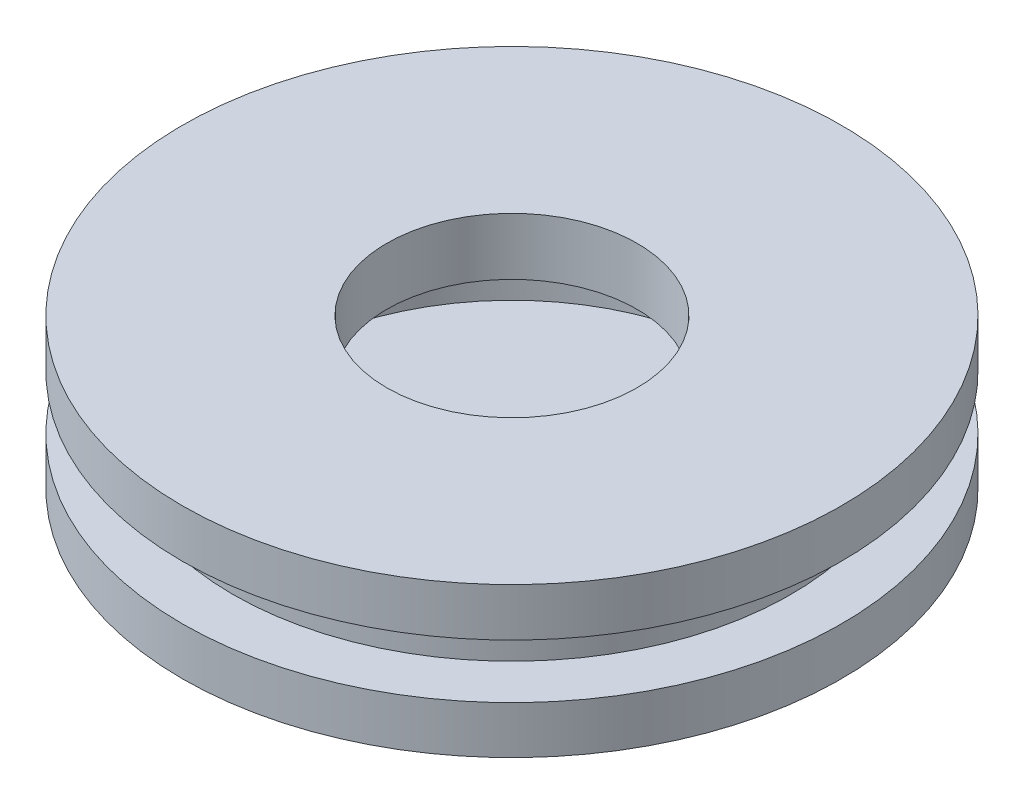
SolidWorks part; units mm, degrees
ref_plane "Front Plane" through (0, 0, 0) normal (0, 0, 1) x (1, 0, 0)
ref_plane "Top Plane" through (0, 0, 0) normal (0, 1, 0) x (1, 0, 0)
ref_plane "Right Plane" through (0, 0, 0) normal (1, 0, 0) x (0, 0, -1)
sketch "Sketch1" plane through (0, 0, 0) normal (0, 0, 1) x (1, 0, 0)
  line L0 (0, 0) -> (-6.5, 0)
  line L1 (-6.5, 0) -> (-6.5, -0.9483)
  line L2 (-6.5, -0.9483) -> (-5.5, -0.9483)
  line L3 (-5.5, -0.9483) -> (-5.5, -2.0163)
  line L4 (-5.5, -2.0163) -> (-6.5, -2.0163)
  line L5 (-6.5, -2.0163) -> (-6.5, -2.9554)
  line L6 (-6.5, -2.9554) -> (0, -4.318)
  line L7 (0, -4.318) -> (0, 0)
  dimension "D1" = 6.5
  dimension "D2" = 5.5
  dimension "D3" = 1.068
  dimension "D4" = 101.84
  dimension "D5" = 0.9483
  dimension "D6" = 4.318
revolve "Revolve1" add sketch "Sketch1" angle 360 about L7
sketch "Sketch3" plane through (0, 0, 0) normal (1, 0, 0) x (0, 0, -1)
  line L0 (0, 0.988) -> (0, -2.9554)
  line L1 (-6.5, -2.9554) -> (6.5, -2.9554) construction
  line L2 (0, -2.9554) -> (-4.5487, -2.9554)
  line L3 (-4.5487, -2.9554) -> (-4.5487, -1.1277)
  line L4 (-4.5487, -1.1277) -> (-2.4693, -1.1277)
  line L5 (-2.4693, -1.1277) -> (-2.4693, 0.988)
  line L6 (-2.4693, 0.988) -> (0, 0.988)
  line L8 (6.5, 0) -> (-6.5, 0) construction
  dimension "D1" = 3.9434
  dimension "D2" = 2.1157
  dimension "D3" = 2.4693
  dimension "D4" = 4.5487
revolve "Cut-Revolve1" cut sketch "Sketch3" angle 360 about L0
